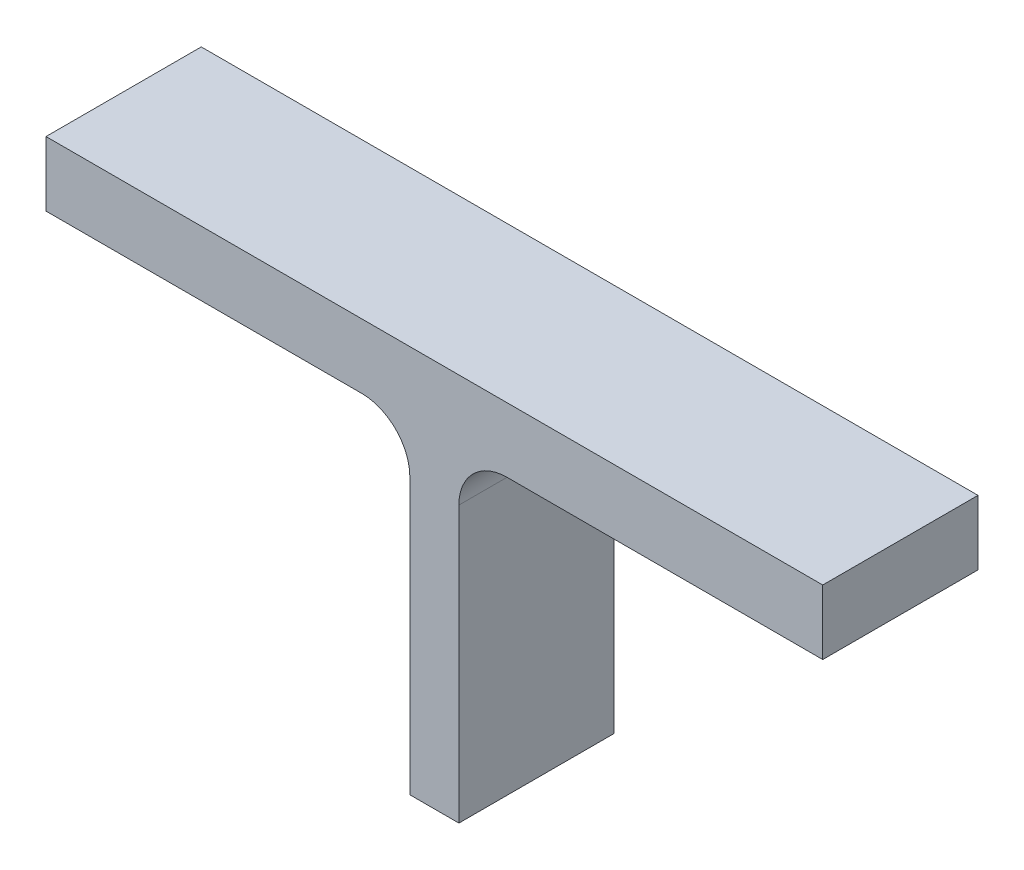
SolidWorks part; units mm, degrees
ref_plane "Plane1" through (0, 0, 0) normal (0, 0, 1) x (1, 0, 0)
ref_plane "Plane2" through (0, 0, 0) normal (0, 1, 0) x (1, 0, 0)
ref_plane "Plane3" through (0, 0, 0) normal (1, 0, 0) x (0, 0, -1)
sketch "Sketch1" plane through (0, 0, 0) normal (0, 0, 1) x (1, 0, 0)
  line L0 (-4.0132, 0) -> (4.0132, 0)
  line L2 (-4.0132, 0) -> (-4.0132, 45.0596)
  line L3 (-11.8872, 52.9336) -> (-63.5381, 52.9336)
  line L4 (-63.5381, 52.9336) -> (-63.5381, 63.5)
  line L5 (-63.5381, 63.5) -> (63.5381, 63.5)
  line L6 (63.5381, 63.5) -> (63.5381, 52.9336)
  line L7 (63.5381, 52.9336) -> (11.8872, 52.9336)
  line L8 (4.0132, 45.0596) -> (4.0132, 0)
  line L12 (0, 0) -> (0, 63.5) construction
  arc A1 (-4.0132, 45.0596) -> (-11.8872, 52.9336) centre (-11.8872, 45.0596) ccw
  arc A2 (11.8872, 52.9336) -> (4.0132, 45.0596) centre (11.8872, 45.0596) ccw
extrude "BaseSteelMT" add sketch "Sketch1" against normal mid plane 25.4
equation "\"D1@Sketch1\" = \"Tw@Sketch1\" / 2"
